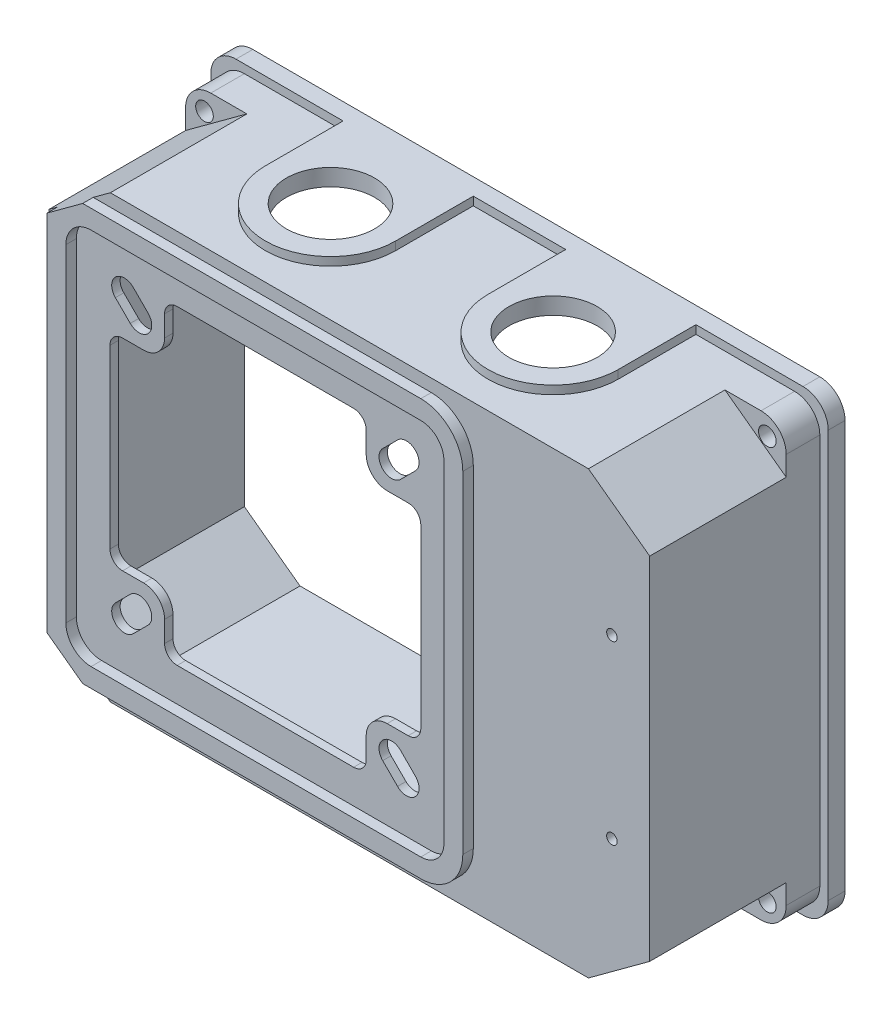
SolidWorks part; units mm, degrees
ref_plane "前视基准面" through (0, 0, 0) normal (0, 0, 1) x (1, 0, 0)
ref_plane "上视基准面" through (0, 0, 0) normal (0, 1, 0) x (1, 0, 0)
ref_plane "右视基准面" through (0, 0, 0) normal (1, 0, 0) x (0, 0, -1)
sketch "草图1" plane through (0, 0, 0) normal (0, 0, 1) x (1, 0, 0)
  line L1 (-60.2896, -52.5) -> (60.2896, -52.5)
  line L2 (-71.5, -44.2686) -> (-71.5, 44.2686)
  line L3 (-60.2896, 52.5) -> (60.2896, 52.5)
  line L4 (71.5, -44.2686) -> (71.5, 44.2686)
  line L5 (-65.8948, -48.3843) -> (65.8948, 48.3843) construction
  line L6 (-65.8948, 48.3843) -> (65.8948, -48.3843) construction
  line L7 (-71.5, 44.2686) -> (-60.2896, 52.5)
  line L8 (-71.5, -44.2686) -> (-60.2896, -52.5)
  line L10 (-71.5, -52.5) -> (71.5, 52.5) construction
  line L11 (-71.5, 52.5) -> (71.5, -52.5) construction
  line L12 (-117.6645, -10.3716) -> (25.3355, -115.3716) construction
  line L13 (-117.6645, 10.3716) -> (25.3355, 115.3716) construction
  line L14 (60.2896, 52.5) -> (71.5, 44.2686)
  line L18 (60.2896, -52.5) -> (71.5, -44.2686)
  point P0 (0, 0)
  dimension "D4" = 78
  dimension "D5" = 78
extrude "凸台-拉伸1" add sketch "草图1" along normal blind 40.5
shell "抽壳1" thickness 2
sketch "草图2" plane through (0, 0, 0) normal (0, 0, -1) x (-1, 0, 0)
  line L0 (-59.6342, 50.5) -> (-69.5, 43.2559)
  line L1 (-69.5, 43.2559) -> (-69.5, -43.2559)
  line L2 (-69.5, -43.2559) -> (-59.6342, -50.5)
  line L3 (-59.6342, -50.5) -> (59.6342, -50.5)
  line L4 (59.6342, -50.5) -> (69.5, -43.2559)
  line L5 (69.5, -43.2559) -> (69.5, 43.2559)
  line L6 (69.5, 43.2559) -> (59.6342, 50.5)
  line L7 (59.6342, 50.5) -> (-59.6342, 50.5)
  line L8 (-60.2896, 52.5) -> (-71.5, 44.2686)
  line L9 (-71.5, 44.2686) -> (-71.5, -44.2686)
  line L10 (-71.5, -44.2686) -> (-60.2896, -52.5)
  line L11 (-60.2896, -52.5) -> (60.2896, -52.5)
  line L12 (60.2896, -52.5) -> (71.5, -44.2686)
  line L13 (71.5, -44.2686) -> (71.5, 44.2686)
  line L14 (71.5, 44.2686) -> (60.2896, 52.5)
  line L15 (60.2896, 52.5) -> (-60.2896, 52.5)
  line L17 (-71.5, 52.5) -> (-71.5, -52.5)
  line L19 (-71.5, -52.5) -> (71.5, -52.5)
  line L21 (71.5, -52.5) -> (71.5, 52.5)
  line L23 (71.5, 52.5) -> (-71.5, 52.5)
  line L24 (-60.2896, 52.5) -> (-71.5, 44.2686) construction
  line L25 (60.2896, 52.5) -> (-60.2896, 52.5) construction
  line L26 (-71.5, 44.2686) -> (-71.5, -44.2686) construction
  line L27 (71.5, 44.2686) -> (60.2896, 52.5) construction
  line L28 (71.5, -44.2686) -> (71.5, 44.2686) construction
  line L29 (60.2896, -52.5) -> (71.5, -44.2686) construction
  line L30 (-60.2896, -52.5) -> (60.2896, -52.5) construction
  line L31 (-71.5, -44.2686) -> (-60.2896, -52.5) construction
  dimension "D1" = 0
  dimension "D2" = 2
extrude "凸台-拉伸2" add sketch "草图2" against normal blind 8
sketch "草图3" plane through (0, 0, 0) normal (0, 0, -1) x (-1, 0, 0)
  line L0 (73.5, 54.5) -> (-73.5, 54.5)
  line L1 (-73.5, 54.5) -> (-73.5, -54.5)
  line L2 (-73.5, -54.5) -> (73.5, -54.5)
  line L3 (73.5, -54.5) -> (73.5, 54.5)
  line L4 (71.5, 52.5) -> (-71.5, 52.5)
  line L5 (-71.5, 52.5) -> (-71.5, -52.5)
  line L6 (-71.5, -52.5) -> (71.5, -52.5)
  line L7 (71.5, -52.5) -> (71.5, 52.5)
  line L8 (71.5, 52.5) -> (-71.5, 52.5)
  line L9 (-71.5, 52.5) -> (-71.5, -52.5)
  line L10 (-71.5, -52.5) -> (71.5, -52.5)
  line L11 (71.5, -52.5) -> (71.5, 52.5)
  line L13 (71.5, 52.5) -> (-71.5, 52.5) construction
  line L14 (-71.5, 52.5) -> (-71.5, -52.5) construction
  line L16 (71.5, -52.5) -> (71.5, 52.5) construction
  line L18 (-71.5, -52.5) -> (71.5, -52.5) construction
  dimension "D1" = 0
  dimension "D2" = 2
extrude "凸台-拉伸3" add sketch "草图3" along normal blind 4 separate body
sketch "草图4" plane through (0, 0, 0) normal (0, 0, -1) x (-1, 0, 0)
  line L0 (59.6342, 50.5) -> (-59.6342, 50.5)
  line L1 (-69.5, 43.2559) -> (-69.5, -43.2559)
  line L2 (-59.6342, -50.5) -> (59.6342, -50.5)
  line L3 (69.5, -43.2559) -> (69.5, 43.2559)
  line L4 (73.5, 54.5) -> (-73.5, 54.5)
  line L6 (-73.5, 54.5) -> (-73.5, -54.5)
  line L12 (-69.5, 43.2559) -> (-59.6342, 50.5)
  line L13 (59.6342, 50.5) -> (69.5, 43.2559)
  line L14 (59.6342, -50.5) -> (69.5, -43.2559)
  line L15 (-59.6342, -50.5) -> (-69.5, -43.2559)
  line L16 (-73.5, -54.5) -> (73.5, -54.5)
  line L18 (73.5, -54.5) -> (73.5, 54.5)
  line L20 (-73.5, 45.2813) -> (-60.9451, 54.5) construction
  line L21 (60.9451, 54.5) -> (-60.9451, 54.5) construction
  line L22 (-73.5, 45.2813) -> (-73.5, -45.2813) construction
  line L23 (60.9451, 54.5) -> (73.5, 45.2813) construction
  line L24 (73.5, -45.2813) -> (73.5, 45.2813) construction
  line L25 (60.9451, -54.5) -> (73.5, -45.2813) construction
  line L26 (-60.9451, -54.5) -> (60.9451, -54.5) construction
  line L27 (-60.9451, -54.5) -> (-73.5, -45.2813) construction
  dimension "D1" = 4
extrude "凸台-拉伸4" add sketch "草图4" along normal blind 4
fillet "圆角3" radius 6 4 edges at (71.5, -52.5, 4) (71.5, 52.5, 4) (-71.5, 52.5, 4) (-71.5, -52.5, 4)
fillet "圆角4" radius 6 4 edges at (73.5, 54.5, -2) (-73.5, 54.5, -2) (-73.5, -54.5, -2) (73.5, -54.5, -2)
sketch "草图5" plane through (0, 0, 40.5) normal (0, 0, 1) x (1, 0, 0)
  line L0 (-71.5, 46.5) -> (-71.5, -46.5) construction
  line L1 (-64.3754, 49.5) -> (19.5, 49.5)
  line L2 (-69.5, 45.7371) -> (-69.5, -45.7371)
  line L3 (-64.3754, -49.5) -> (19.5, -49.5)
  line L4 (29.5, 39.5) -> (29.5, -39.5)
  line L5 (-68.0687, 46.7149) -> (29.5, -49.5) construction
  line L6 (-67.0611, -47.1519) -> (29.5, 49.5) construction
  line L7 (-67.5, 54.5) -> (67.5, 54.5) construction
  line L8 (-60.2896, -52.5) -> (60.2896, -52.5) construction
  line L11 (-60.2896, 52.5) -> (-71.5, 44.2686) construction
  line L13 (-60.2896, -52.5) -> (-71.5, -44.2686) construction
  line L14 (-64.3754, 49.5) -> (-69.5, 45.7371)
  line L16 (-59, 45) -> (19.5, 45)
  line L17 (25, 39.5) -> (25, -39.5)
  line L18 (-59, -45) -> (19.5, -45)
  line L20 (-65, 39) -> (-65, -39)
  line L22 (-69.5, -45.7371) -> (-63.0135, -49.5) construction
  line L23 (-63.0135, -49.5) -> (19.5, -49.5) construction
  line L24 (-69.5, -45.7371) -> (-64.3754, -49.5)
  line L26 (-62.9007, 45) -> (-65, 43.4585) construction
  line L27 (-65, 43.4585) -> (-65, -43.1452) construction
  line L28 (-62.9007, 45) -> (19.5, 45) construction
  line L29 (-65, -43.1452) -> (-61.8027, -45) construction
  line L30 (-61.8027, -45) -> (19.5, -45) construction
  arc A0 (19.5, -49.5) -> (29.5, -39.5) centre (19.5, -39.5) ccw
  arc A1 (29.5, 39.5) -> (19.5, 49.5) centre (19.5, 39.5) ccw
  arc A2 (25, 39.5) -> (19.5, 45) centre (19.5, 39.5) ccw
  arc A3 (19.5, -45) -> (25, -39.5) centre (19.5, -39.5) ccw
  arc A4 (-65, 39) -> (-59, 45) centre (-59, 39) cw
  arc A5 (-59, -45) -> (-65, -39) centre (-59, -39) cw
  point P0 (-20.3222, -0.3691)
  dimension "D5" = 10
  dimension "D7" = 6
  dimension "D1" = 2
  dimension "D2" = 5
  dimension "D3" = 3
  dimension "D4" = 99
  dimension "D6" = 4.5
extrude "凸台-拉伸5" add sketch "草图5" along normal blind 2.5
sketch "草图6" plane through (0, 0, -4) normal (0, 0, -1) x (-1, 0, 0)
  line L0 (0, 0) -> (67, 0) construction
  line L1 (67, 0) -> (67, 48) construction
  circle A0 centre (67, 48) radius 1
  circle A1 centre (-67, 48) radius 1
  circle A2 centre (-67, -48) radius 1
  circle A3 centre (67, -48) radius 1
  dimension "D2" = 2
  dimension "D1" = 67
  dimension "D3" = 2
extrude "切除-拉伸1" cut sketch "草图6" against normal blind 0.5 draft 45
hole_wizard "M5 螺纹孔1" positions "草图7" profile "草图8" tap size "M5" standard "GB"
sketch "草图7" plane through (0, 0, -4) normal (0, 0, -1) x (-1, 0, 0)
  point P0 (67, 48)
  point P3 (67, -48)
  point P6 (-67, -48)
  point P9 (-67, 48)
sketch "草图8" plane through (-67, 48, -4) normal (1, 0, 0) x (0, 1, 0)
  line L0 (0, 0) -> (0, 15.2618)
  line L1 (0, 15.2618) -> (2.1, 14)
  line L2 (2.1, 14) -> (2.1, 0)
  line L5 (2.1, 0) -> (0, 0)
  line L10 (0, 15.2618) -> (-2.1, 14) construction
  line L11 (0, -6.35) -> (0, 107.95) construction
  dimension "螺纹孔钻头直径" = 4.2
  dimension "螺纹孔钻头深度" = 14
  dimension "导头角度" = 118
sketch "草图9" plane through (0, 0, 8) normal (0, 0, 1) x (1, 0, 0)
  line L0 (-71.5, 41.7874) -> (-56.9104, 52.5)
  line L4 (-71.5, 44.2686) -> (-68.466, 46.4964)
  line L5 (-65.1264, 48.9485) -> (-60.2896, 52.5)
  line L6 (-60.2896, 52.5) -> (-65.5, 52.5)
  line L7 (-71.5, 46.5) -> (-71.5, 44.2686)
  line L10 (-56.9104, 52.5) -> (-65.5, 52.5)
  line L11 (-71.5, 46.5) -> (-71.5, 41.7874)
  arc A2 (-65.1264, 48.9485) -> (-68.466, 46.4964) centre (-67, 48) ccw
  arc A3 (-65.5, 52.5) -> (-71.5, 46.5) centre (-65.5, 46.5) ccw
  arc A5 (-65.5, 52.5) -> (-71.5, 46.5) centre (-65.5, 46.5) ccw
  dimension "D1" = 0
extrude "切除-拉伸3" cut sketch "草图9" along normal up to surface (35 mm away)
sketch "草图10" plane through (0, 0, 8) normal (0, 0, 1) x (1, 0, 0)
  line L4 (-60.2896, -52.5) -> (-65.1264, -48.9485)
  line L5 (-68.466, -46.4964) -> (-71.5, -44.2686)
  line L6 (-71.5, -44.2686) -> (-71.5, -46.5)
  line L7 (-65.5, -52.5) -> (-60.2896, -52.5)
  line L10 (-71.5, -41.7874) -> (-71.5, -46.5)
  line L11 (-65.5, -52.5) -> (-56.9104, -52.5)
  line L16 (-54.1866, -54.5) -> (-73.5, -40.3188)
  line L17 (-73.5, -40.3188) -> (-73.5, -46.5)
  line L18 (-65.5, -54.5) -> (-54.1866, -54.5)
  line L19 (-56.9104, -52.5) -> (-71.5, -41.7874)
  arc A2 (-68.466, -46.4964) -> (-65.1264, -48.9485) centre (-67, -48) ccw
  arc A3 (-71.5, -46.5) -> (-65.5, -52.5) centre (-65.5, -46.5) ccw
  arc A5 (-71.5, -46.5) -> (-65.5, -52.5) centre (-65.5, -46.5) ccw
  circle A8 centre (-67, -48) radius 0.1
  arc A9 (-73.5, -46.5) -> (-65.5, -54.5) centre (-65.5, -46.5) ccw
  circle A10 centre (-67, -48) radius 0.1
  dimension "D1" = 0
  dimension "D2" = 2
extrude "切除-拉伸4" cut sketch "草图10" along normal up to surface (35 mm away)
sketch "草图11" plane through (0, 0, 38.5) normal (0, 0, -1) x (-1, 0, 0)
  line L0 (-56.255, 50.5) -> (-69.5, 40.7747)
  line L1 (69.5, 40.7747) -> (56.255, 50.5)
  line L2 (53.5312, -52.5) -> (71.5, -39.3061)
  line L3 (-69.5, -40.7747) -> (-56.255, -50.5)
  line L4 (-58.4505, 48.8879) -> (-68.3163, 41.6438) construction
  line L5 (-68.3163, -41.6438) -> (-58.4505, -48.8879) construction
  line L6 (-69.5, -40.7747) -> (-69.5, -43.2559)
  line L7 (68.3163, 41.6438) -> (58.4505, 48.8879) construction
  line L8 (-59.6342, 50.5) -> (-69.5, 43.2559)
  line L9 (-69.5, 43.2559) -> (-69.5, -43.2559)
  line L10 (-69.5, -43.2559) -> (-59.6342, -50.5)
  line L11 (-59.6342, -50.5) -> (59.6342, -50.5)
  line L12 (59.6342, -50.5) -> (69.5, -43.2559)
  line L13 (69.5, -43.2559) -> (69.5, 43.2559)
  line L14 (69.5, 43.2559) -> (59.6342, 50.5)
  line L15 (59.6342, 50.5) -> (-59.6342, 50.5)
  line L16 (-59.6342, 50.5) -> (-69.5, 43.2559)
  line L17 (-69.5, 43.2559) -> (-69.5, 40.7747)
  line L18 (-69.5, -43.2559) -> (-59.6342, -50.5)
  line L19 (-59.6342, -50.5) -> (-56.255, -50.5)
  line L22 (69.5, 43.2559) -> (59.6342, 50.5)
  line L23 (59.6342, 50.5) -> (56.255, 50.5)
  line L24 (69.5, 43.2559) -> (69.5, 40.7747)
  line L25 (-56.255, 50.5) -> (-59.6342, 50.5)
  line L27 (56.9104, -52.5) -> (71.5, -41.7874)
  line L28 (56.9104, -52.5) -> (53.5312, -52.5)
  line L29 (65.5, -52.5) -> (-65.5, -52.5) construction
  line L32 (71.5, -39.3061) -> (71.5, -41.7874)
  line L34 (71.5, 41.7874) -> (71.5, -41.7874) construction
  dimension "D1" = 0
  dimension "D2" = 2
extrude "凸台-拉伸6" add sketch "草图11" along normal up to surface (42.5 mm away)
sketch "草图12" plane through (0, 0, 8) normal (0, 0, 1) x (1, 0, 0)
  line L2 (71.5, 44.2686) -> (71.5, 46.5) construction
  line L3 (65.5, 52.5) -> (60.2896, 52.5) construction
  line L6 (60.2896, -52.5) -> (65.5, -52.5) construction
  line L7 (71.5, -46.5) -> (71.5, -44.2686) construction
  line L10 (71.5, 41.7874) -> (71.5, 46.5)
  line L11 (65.5, 52.5) -> (56.9104, 52.5)
  line L14 (56.9104, -52.5) -> (65.5, -52.5)
  line L15 (71.5, -46.5) -> (71.5, -41.7874)
  line L16 (56.9104, 52.5) -> (71.5, 41.7874)
  line L27 (71.5, -41.7874) -> (56.9104, -52.5)
  arc A1 (71.5, 46.5) -> (65.5, 52.5) centre (65.5, 46.5) ccw construction
  arc A3 (65.5, -52.5) -> (71.5, -46.5) centre (65.5, -46.5) ccw construction
  arc A5 (71.5, 46.5) -> (65.5, 52.5) centre (65.5, 46.5) ccw
  arc A7 (65.5, -52.5) -> (71.5, -46.5) centre (65.5, -46.5) ccw
extrude "切除-拉伸5" cut sketch "草图12" along normal up to surface (32.5 mm away)
sketch "草图14" plane through (0, 0, 40.5) normal (0, 0, 1) x (1, 0, 0)
  line L0 (1, 37) -> (-41, 37)
  line L1 (-57, 21) -> (-57, -21)
  line L2 (-41, -37) -> (1, -37)
  line L3 (17, -21) -> (17, 21)
  line L4 (-44, 34) -> (-44, 29)
  line L5 (-54, -24) -> (-49, -24)
  line L6 (4, -34) -> (4, -29)
  line L12 (4, 24) -> (-44, 24) construction
  line L13 (-44, 24) -> (-44, -24) construction
  line L14 (4, -24) -> (4, 24) construction
  line L15 (-44, -24) -> (4, -24) construction
  line L16 (17, 37) -> (-57, 37) construction
  line L17 (-57, 37) -> (-57, -37) construction
  line L18 (17, -37) -> (17, 37) construction
  line L19 (-57, -37) -> (17, -37) construction
  line L20 (9, -24) -> (14, -24)
  line L21 (-44, -29) -> (-44, -34)
  line L22 (4, 29) -> (4, 34)
  line L23 (-49, 24) -> (-54, 24)
  line L24 (9, 24) -> (14, 24)
  arc A8 (9, 24) -> (4, 29) centre (9, 29) cw
  arc A9 (9, -24) -> (4, -29) centre (9, -29) ccw
  arc A10 (-44, -29) -> (-49, -24) centre (-49, -29) ccw
  arc A11 (-44, 29) -> (-49, 24) centre (-49, 29) cw
  arc A18 (17, 21) -> (14, 24) centre (14, 21) ccw
  arc A19 (4, 34) -> (1, 37) centre (1, 34) ccw
  arc A20 (17, -21) -> (14, -24) centre (14, -21) cw
  arc A21 (4, -34) -> (1, -37) centre (1, -34) cw
  arc A22 (-41, -37) -> (-44, -34) centre (-41, -34) cw
  arc A23 (-54, -24) -> (-57, -21) centre (-54, -21) cw
  arc A24 (-41, 37) -> (-44, 34) centre (-41, 34) ccw
  arc A25 (-57, 21) -> (-54, 24) centre (-54, 21) cw
  point P42 (-44, -24)
  point P45 (-44, 24)
  dimension "D2" = 3
  dimension "D3" = 3
  dimension "D1" = 13
extrude "切除-拉伸6" cut sketch "草图14" against normal blind 10
sketch "草图15" plane through (0, 0, 40.5) normal (0, 0, 1) x (1, 0, 0)
  line L0 (10.052, 30.052) -> (-20, 0) construction
  line L1 (-20, 37) -> (-20, -37) construction
  line L2 (1, 37) -> (-41, 37) construction
  line L3 (-41, -37) -> (1, -37) construction
  line L4 (10.052, 30.052) -> (13.5876, 33.5876) construction
  line L5 (7.9307, 32.1734) -> (11.4663, 35.7089)
  line L6 (12.1734, 27.9307) -> (15.7089, 31.4663)
  line L7 (10.052, -30.052) -> (13.5876, -33.5876) construction
  line L8 (12.1734, -27.9307) -> (15.7089, -31.4663)
  line L9 (7.9307, -32.1734) -> (11.4663, -35.7089)
  line L10 (-50.052, -30.052) -> (-53.5876, -33.5876) construction
  line L11 (-47.9307, -32.1734) -> (-51.4663, -35.7089)
  line L12 (-52.1734, -27.9307) -> (-55.7089, -31.4663)
  line L13 (-50.052, 30.052) -> (-53.5876, 33.5876) construction
  line L14 (-52.1734, 27.9307) -> (-55.7089, 31.4663)
  line L15 (-47.9307, 32.1734) -> (-51.4663, 35.7089)
  arc A2 (7.9307, 32.1734) -> (12.1734, 27.9307) centre (10.052, 30.052) ccw
  arc A3 (15.7089, 31.4663) -> (11.4663, 35.7089) centre (13.5876, 33.5876) ccw
  arc A4 (12.1734, -27.9307) -> (7.9307, -32.1734) centre (10.052, -30.052) ccw
  arc A5 (11.4663, -35.7089) -> (15.7089, -31.4663) centre (13.5876, -33.5876) ccw
  arc A6 (-47.9307, -32.1734) -> (-52.1734, -27.9307) centre (-50.052, -30.052) ccw
  arc A7 (-55.7089, -31.4663) -> (-51.4663, -35.7089) centre (-53.5876, -33.5876) ccw
  arc A8 (-52.1734, 27.9307) -> (-47.9307, 32.1734) centre (-50.052, 30.052) ccw
  arc A9 (-51.4663, 35.7089) -> (-55.7089, 31.4663) centre (-53.5876, 33.5876) ccw
  point P2 (11.8198, 31.8198)
  point P7 (7.9307, 27.9307)
  point P15 (15.7089, 35.7089)
  point P20 (11.8198, -31.8198)
  point P27 (-51.8198, -31.8198)
  point P34 (-51.8198, 31.8198)
  point P40 (-20, 0)
  dimension "D1" = 42.5
  dimension "D2" = 6
  dimension "D3" = 11
  dimension "D4" = 4
extrude "切除-拉伸7" cut sketch "草图15" against normal blind 10
sketch "草图16" plane through (0, 0, 38.5) normal (0, 0, -1) x (-1, 0, 0)
  line L0 (-69.5, 0) -> (-30, 0) construction
  line L1 (-30, 30) -> (-30, 7)
  line L2 (-43, 30) -> (-43, 14.0825)
  line L3 (-69.5, 40.7747) -> (-69.5, -40.7747) construction
  line L4 (-43, 25.5886) -> (-43, -16.4114) construction
  line L5 (-30, 25.5886) -> (-30, -16.4114) construction
  line L8 (-30, 0) -> (-27, 0) construction
  line L9 (-27, 5) -> (-28, 5)
  line L10 (-27, -5) -> (-28, -5)
  line L11 (-30, -7) -> (-30, -30)
  line L12 (-47, 11.0825) -> (-47, 6.7082)
  line L13 (-45, 13.0825) -> (-44, 13.0825)
  line L14 (-45, -10.9175) -> (-44, -10.9175)
  line L15 (-47, 30) -> (-47, -30) construction
  line L16 (-47, -6.7082) -> (-47, -8.9175)
  line L17 (-43, -11.9175) -> (-43, -30)
  line L18 (-43, 30) -> (-43, -30) construction
  arc A2 (-43, -30) -> (-30, -30) centre (-36.5, -30) ccw
  arc A4 (-30, 30) -> (-43, 30) centre (-36.5, 30) ccw
  arc A6 (-27, -5) -> (-27, 5) centre (-27, 0) ccw
  arc A8 (-48.4286, 4.7916) -> (-48.4286, -4.7916) centre (-47, 0) ccw
  arc A9 (-47, -6.7082) -> (-48.4286, -4.7916) centre (-49, -6.7082) ccw
  arc A10 (-47, 6.7082) -> (-48.4286, 4.7916) centre (-49, 6.7082) cw
  arc A11 (-30, -7) -> (-28, -5) centre (-28, -7) cw
  arc A12 (-28, 5) -> (-30, 7) centre (-28, 7) cw
  arc A13 (-45, -10.9175) -> (-47, -8.9175) centre (-45, -8.9175) cw
  arc A14 (-47, 11.0825) -> (-45, 13.0825) centre (-45, 11.0825) cw
  arc A15 (-43, -11.9175) -> (-44, -10.9175) centre (-44, -11.9175) ccw
  arc A16 (-43, 14.0825) -> (-44, 13.0825) centre (-44, 14.0825) cw
  point P43 (-43, -10.9175)
  dimension "D1" = 4
  dimension "D3" = 2
  dimension "D4" = 2
  dimension "D5" = 2
  dimension "D6" = 1
  dimension "D2" = 13
extrude "凸台-拉伸7" add sketch "草图16" along normal blind 3 draft 3
sketch "草图17" plane through (0, 0, 38.5) normal (0, 0, -1) x (-1, 0, 0)
  line L0 (-73.5, 0) -> (-62.5, 0) construction
  line L1 (-73.5, 48.5) -> (-73.5, -48.5) construction
  line L2 (-62.5, 0) -> (-62.5, 21) construction
  circle A0 centre (-62.5, 21) radius 3.5
  circle A1 centre (-62.5, -21) radius 3.5
extrude "凸台-拉伸8" add sketch "草图17" along normal blind 3
hole_wizard "M3 螺纹孔1" positions "草图18" profile "草图19" tap size "M3" standard "GB"
sketch "草图18" plane through (0, 0, 35.5) normal (0, 0, -1) x (-1, 0, 0)
  point P0 (-62.5, 21)
  point P3 (-62.5, -21)
sketch "草图19" plane through (62.5, 21, 35.5) normal (1, 0, 0) x (0, 1, 0)
  line L0 (0, 0) -> (0, 9.2511)
  line L1 (0, 9.2511) -> (1.25, 8.5)
  line L2 (1.25, 8.5) -> (1.25, 0)
  line L5 (1.25, 0) -> (0, 0)
  line L10 (0, 9.2511) -> (-1.25, 8.5) construction
  line L11 (0, -6.35) -> (0, 107.95) construction
  dimension "螺纹孔钻头直径" = 2.5
  dimension "螺纹孔钻头深度" = 8.5
  dimension "导头角度" = 118
sketch "草图20" plane through (0, 52.5, 0) normal (0, 1, 0) x (1, 0, 0)
  line L0 (0, 4) -> (0, -40.5) construction
  line L1 (-67.5, 4) -> (67.5, 4) construction
  line L2 (56.9104, -40.5) -> (-56.9104, -40.5) construction
  line L3 (-42, 4) -> (-11, 4)
  line L4 (11, 4) -> (11, -18.5)
  line L5 (-42, 4) -> (-42, -18.5)
  line L6 (42, 4) -> (11, 4)
  line L7 (-11, 4) -> (-11, -18.5)
  line L8 (42, 4) -> (42, -18.5)
  arc A0 (-42, -18.5) -> (-11, -18.5) centre (-26.5, -18.5) ccw
  arc A1 (42, -18.5) -> (11, -18.5) centre (26.5, -18.5) cw
extrude "凸台-拉伸9" add sketch "草图20" along normal up to surface (2 mm away)
hole_wizard "M24 螺纹孔1" positions "草图21" profile "草图22" tap size "M24" standard "GB"
sketch "草图21" plane through (0, 54.5, 0) normal (0, 1, 0) x (1, 0, 0)
  point P0 (26.5, -18.5)
  point P3 (-26.5, -18.5)
sketch "草图22" plane through (26.5, 54.5, 18.5) normal (1, 0, 0) x (0, 0, 1)
  line L0 (0, 0) -> (0, 69.309)
  line L1 (0, 69.309) -> (10.5, 63)
  line L2 (10.5, 63) -> (10.5, 0)
  line L5 (10.5, 0) -> (0, 0)
  line L10 (0, 69.309) -> (-10.5, 63) construction
  line L11 (0, -6.35) -> (0, 107.95) construction
  dimension "螺纹孔钻头直径" = 21
  dimension "螺纹孔钻头深度" = 63
  dimension "导头角度" = 118
sketch "草图23" plane through (0, -52.5, 0) normal (0, -1, 0) x (1, 0, 0)
  line L0 (0, -4) -> (0, 40.5) construction
  line L1 (67.5, -4) -> (-67.5, -4) construction
  line L2 (-56.9104, 40.5) -> (56.9104, 40.5) construction
  line L3 (11, -4) -> (42, -4)
  line L4 (-11, -4) -> (-42, -4)
  line L5 (42, -4) -> (42, 18.5)
  line L6 (11, -4) -> (11, 18.5)
  line L7 (-42, -4) -> (-42, 18.5)
  line L8 (-11, -4) -> (-11, 18.5)
  arc A0 (42, 18.5) -> (11, 18.5) centre (26.5, 18.5) ccw
  arc A1 (-42, 18.5) -> (-11, 18.5) centre (-26.5, 18.5) cw
extrude "凸台-拉伸10" add sketch "草图23" along normal up to surface (2 mm away)
hole_wizard "M24 螺纹孔2" positions "草图24" profile "草图25" tap size "M24" standard "GB"
sketch "草图24" plane through (0, -54.5, 0) normal (0, -1, 0) x (-1, 0, 0)
  point P0 (-26.5, -18.5)
sketch "草图25" plane through (26.5, -54.5, 18.5) normal (1, 0, 0) x (0, 0, -1)
  line L0 (0, 0) -> (0, 69.309)
  line L1 (0, 69.309) -> (10.5, 63)
  line L2 (10.5, 63) -> (10.5, 0)
  line L5 (10.5, 0) -> (0, 0)
  line L10 (0, 69.309) -> (-10.5, 63) construction
  line L11 (0, -6.35) -> (0, 107.95) construction
  dimension "螺纹孔钻头直径" = 21
  dimension "螺纹孔钻头深度" = 63
  dimension "导头角度" = 118
